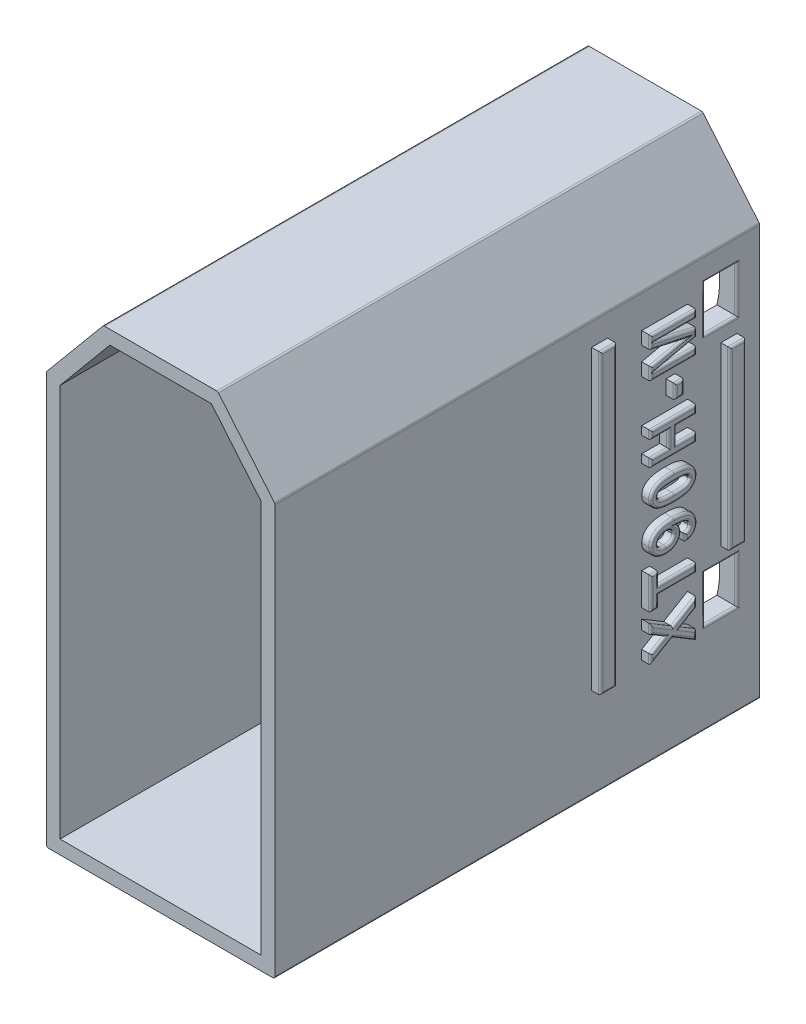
SolidWorks part; units mm, degrees
ref_plane "Спереди" through (0, 0, 0) normal (0, 0, 1) x (1, 0, 0)
ref_plane "Сверху" through (0, 0, 0) normal (0, 1, 0) x (1, 0, 0)
ref_plane "Справа" through (0, 0, 0) normal (1, 0, 0) x (0, 0, -1)
sketch "Эскиз1" plane through (0, 0, 0) normal (0, 0, 1) x (1, 0, 0)
  line L0 (-5, -10.5) -> (-5, 7.5)
  line L1 (-5, 10.5) -> (5, 10.5) construction
  line L2 (-5, 10.5) -> (-5, -10.5) construction
  line L3 (-5, -10.5) -> (5, -10.5) construction
  line L4 (5, 10.5) -> (5, -10.5) construction
  line L5 (0, -10.5) -> (0, 10.5) construction
  line L6 (-5, 0) -> (5, 0) construction
  line L7 (-5, 7.5) -> (-2.5, 10.5)
  line L8 (-2.5, 10.5) -> (2.5, 10.5)
  line L9 (-5, -10.5) -> (5, -10.5)
  line L10 (5, -10.5) -> (5, 7.5)
  line L11 (5, 7.5) -> (2.5, 10.5)
  line L12 (-4.4, -9.9) -> (4.4, -9.9)
  line L13 (4.4, -9.9) -> (4.4, 7.2828)
  line L14 (4.4, 7.2828) -> (2.219, 9.9)
  line L15 (-2.219, 9.9) -> (2.219, 9.9)
  line L16 (-4.4, 7.2828) -> (-2.219, 9.9)
  line L17 (-4.4, -9.9) -> (-4.4, 7.2828)
  point P0 (0, 0)
  dimension "D1" = 21
  dimension "D2" = 10
  dimension "D3" = 18
  dimension "D4" = 5
  dimension "D5" = 0.6
extrude "Бобышка-Вытянуть1" add sketch "Эскиз1" along normal blind 14.2
sketch "Эскиз2" plane through (0, 0, 0) normal (0, 0, -1) x (-1, 0, 0)
  line L0 (-2.5, 10.5) -> (2.5, 10.5)
  line L1 (2.5, 10.5) -> (5, 7.5)
  line L2 (5, 7.5) -> (5, -10.5)
  line L3 (5, -10.5) -> (-5, -10.5)
  line L4 (-5, -10.5) -> (-5, 7.5)
  line L5 (-5, 7.5) -> (-2.5, 10.5)
extrude "Бобышка-Вытянуть2" add sketch "Эскиз2" along normal blind 7
sketch "Эскиз3" plane through (0, 0, -7) normal (0, 0, -1) x (-1, 0, 0)
  line L0 (0, 0) -> (-5, 0) construction
  line L1 (-5, 7.5) -> (-5, -10.5) construction
  line L2 (0, -10.5) -> (0, 10.5) construction
  line L3 (-5, -10.5) -> (5, -10.5) construction
  line L4 (2.5, 10.5) -> (-2.5, 10.5) construction
  circle A0 centre (0, 5.5) radius 4.25
  circle A1 centre (0, -5.5) radius 4.25
  dimension "D1" = 8.5
  dimension "D2" = 5.5
extrude "Вырез-Вытянуть1" cut sketch "Эскиз3" against normal blind 3.2
sketch "Эскиз4" plane through (0, 0, -7) normal (0, 0, -1) x (-1, 0, 0)
  line L0 (0, 10.5) -> (0, -10.5) construction
  line L1 (2.5, 10.5) -> (-2.5, 10.5) construction
  line L2 (-5, -10.5) -> (5, -10.5) construction
  line L3 (0, -10.5) -> (5, 0) construction
  line L4 (5, -10.5) -> (5, 7.5) construction
  line L5 (5, 0) -> (-5, 0) construction
  line L6 (-5, 7.5) -> (-5, -10.5) construction
  line L7 (-3.5, 2.1425) -> (-3.5, -2.1425)
  line L8 (-3.5, 2.1425) -> (3.5, 2.1425) construction
  line L9 (-3.5, 2.1425) -> (-3.5, -2.1425) construction
  line L10 (-3.5, -2.1425) -> (3.5, -2.1425) construction
  line L11 (3.5, 2.1425) -> (3.5, -2.1425) construction
  line L12 (0, -2.1425) -> (0, 2.1425) construction
  line L13 (-3.5, 0) -> (3.5, 0) construction
  line L14 (3.5, 2.1425) -> (3.5, -2.1425)
  circle A0 centre (0, 5.5) radius 4.85 construction
  circle A1 centre (0, -5.5) radius 4.85 construction
  arc A2 (-3.5, 2.1425) -> (3.5, 2.1425) centre (0, 5.5) ccw
  arc A3 (3.5, -2.1425) -> (-3.5, -2.1425) centre (0, -5.5) ccw
  circle A4 centre (0, 5.5) radius 2.85
  circle A5 centre (0, -5.5) radius 2.85
  point P13 (0, 0)
  dimension "D3" = 9.7
  dimension "D4" = 9.7
  dimension "D1" = 5.7
  dimension "D5" = 5.7
  dimension "D2" = 7
extrude "Вырез-Вытянуть2" cut sketch "Эскиз4" against normal through all
sketch "Эскиз5" plane through (5, 0, 0) normal (1, 0, 0) x (0, 0, -1)
  line L0 (5.3, 10.5) -> (5.3, -10.5) construction
  line L1 (-14.2, 10.5) -> (7, 10.5) construction
  line L2 (-14.2, -10.5) -> (7, -10.5) construction
  line L3 (0, 0) -> (7, 0) construction
  line L4 (7, 7.5) -> (7, -10.5) construction
  line L5 (3.8, 5.5) -> (7, 5.5) construction
  line L6 (3.8, 1.25) -> (3.8, 9.75) construction
  line L7 (4.6, -4.5) -> (6, -4.5)
  line L8 (4.6, 6.5) -> (6, 6.5)
  line L9 (4.6, 6.5) -> (4.6, 4.5)
  line L10 (4.6, 4.5) -> (6, 4.5)
  line L11 (6, 6.5) -> (6, 4.5)
  line L12 (5.3, 4.5) -> (5.3, 6.5) construction
  line L13 (4.6, 5.5) -> (6, 5.5) construction
  line L14 (6, -6.5) -> (6, -4.5)
  line L15 (4.6, -6.5) -> (6, -6.5)
  line L16 (4.6, -6.5) -> (4.6, -4.5)
  point P15 (5.3, 5.5)
  dimension "D1" = 2
  dimension "D2" = 1.4
  dimension "D3" = 1
extrude "Вырез-Вытянуть3" cut sketch "Эскиз5" against normal through all
sketch "Эскиз6" plane through (5, 0, 0) normal (1, 0, 0) x (0, 0, -1)
  line L0 (5.6529, 4.5) -> (5.6529, -4.5) construction
  line L1 (4.6, 4.5) -> (6, 4.5) construction
  line L2 (6, -4.5) -> (4.6, -4.5) construction
  line L3 (0, 10.5) -> (0, -10.5) construction
  line L4 (5.3029, 3.85) -> (6.0029, 3.85)
  line L5 (5.3029, 3.85) -> (5.3029, -3.85)
  line L6 (5.3029, -3.85) -> (6.0029, -3.85)
  line L7 (6.0029, 3.85) -> (6.0029, -3.85)
  line L8 (5.6529, -3.85) -> (5.6529, 3.85) construction
  line L9 (5.3029, 0) -> (6.0029, 0) construction
  line L10 (-14.2, 10.5) -> (7, 10.5) construction
  line L11 (-14.2, -10.5) -> (7, -10.5) construction
  line L12 (7, 7.5) -> (7, -10.5) construction
  line L13 (0.35, -6.5) -> (3.8409, -6.5) construction
  line L14 (-0.35, -6.5) -> (0.35, -6.5)
  line L15 (-0.35, -6.5) -> (-0.35, 6.5)
  line L16 (-0.35, 6.5) -> (0.35, 6.5)
  line L17 (0.35, -6.5) -> (0.35, 6.5)
  line L18 (0, 6.5) -> (0, -6.5) construction
  line L19 (-0.35, 0) -> (0.35, 0) construction
  line L20 (3.8409, -6.5) -> (3.8409, 6.5) construction
  line L21 (3.8409, 6.5) -> (0.35, 6.5) construction
  text T0 "<b>XT90H-M</b>" font "Arial Narrow" height 2
  point P6 (5.6529, 0)
  point P21 (0, 0)
  dimension "D1" = 7.7
  dimension "D2" = 0.7
  dimension "D3" = 7
  dimension "D4" = 13
  dimension "D5" = 0.7
extrude "Бобышка-Вытянуть3" add sketch "Эскиз6" along normal blind 0.4
sketch "Эскиз7" plane through (-5, 0, -5) normal (1, 0, 0) x (0, 0, -1)
  line L9 (0.1058, 0) -> (0.8058, 0) construction
  line L22 (-1.3562, -6.5) -> (-4.8471, -6.5) construction
  line L23 (-1.3562, 6.5) -> (-1.3562, -6.5) construction
  line L24 (-5.5471, 0) -> (-4.8471, 0) construction
  line L25 (-5.1971, -6.5) -> (-5.1971, 6.5) construction
  line L26 (-4.8471, 6.5) -> (-1.3562, 6.5) construction
  line L27 (0.4558, 3.85) -> (0.4558, -3.85) construction
  line L28 (-5.1971, -10.5) -> (-5.1971, 10.5) construction
  line L29 (0.4558, -4.5) -> (0.4558, 4.5) construction
  line L30 (-4.8471, 6.5) -> (-4.8471, -6.5)
  line L31 (-5.5471, -6.5) -> (-4.8471, -6.5)
  line L32 (-5.5471, 6.5) -> (-5.5471, -6.5)
  line L33 (-5.5471, 6.5) -> (-4.8471, 6.5)
  line L34 (0.8058, -3.85) -> (0.8058, 3.85)
  line L35 (0.1058, 3.85) -> (0.8058, 3.85)
  line L36 (0.1058, -3.85) -> (0.1058, 3.85)
  line L37 (0.1058, -3.85) -> (0.8058, -3.85)
  text T0 "<b>XT90H-M</b>" font "Arial Narrow" height 2
  point P6 (0.4558, 0)
  point P21 (-5.1971, 0)
extrude "Бобышка-Вытянуть4" add sketch "Эскиз7" against normal blind 0.4
fillet "Скругление1" radius 0.1 102 edges at (5.4, 4.3, -2.8409) (5.4, 5.3278, -2.5361) (5.4, 5.7629, -1.8409) (5.4, 6.0403, -2.8409) (5.4, 5.8714, -3.8409) (5.4, 4.6377, -3.0408) (5.4, 3.6818, -3.1006) (5.4, 3.3701, -3.2954) (5.4, 1.0117, -2.8409) (5.4, 1.1935, -1.8409) (5.4, 2.2584, -1.8409) (5.4, 2.4403, -2.8409) (5.4, 2.2584, -3.8409) (5.4, 1.726, -2.9578) (5.4, 1.3753, -3.3993) (5.4, -4.1935, -2.1785) (5.4, -4.4532, -2.0097) (5.4, -3.5701, -3.0097) (5.4, -3.7519, -3.8409) (5.4, -6.1881, -3.3192) (5.4, -5.4868, -2.1455) (5.4, -5.1753, -2.3192) (5.4, -5.1494, -3.3192) (5.4, -5.0453, -3.8409) (5.4, -5.4608, -3.4929) (5.4, -6.2924, -3.8409) (5.4, -3.85, -5.6529) (5.4, 3.85, -5.6529) (5.4, 0, -6.0029) (5.4, -6.5, 0) (5.4, 0, 0.35) (5.4, 6.5, 0) (5.4, 0, -0.35) (-5.4, 6.1881, -3.1221) (-5.4, 6.2405, -1.6438) (-5.4, 5.4868, -1.9484) (-5.4, 5.0972, -1.6438) (-5.4, 5.1753, -2.1221) (-5.4, 5.1494, -3.1221) (-5.4, 5.0453, -3.6438) (-5.4, 5.4608, -3.2958) (-5.4, 5.8768, -3.2958) (-5.4, 6.2924, -3.6438) (-5.4, 3.9338, -2.8126) (-5.4, 4.1935, -1.9814) (-5.4, 3.7519, -1.6438) (-5.4, 3.0506, -1.8126) (-5.4, 3.3104, -1.9814) (-5.4, 3.5701, -2.8126) (-5.4, 3.7519, -3.6438) (-5.4, 2.3675, -3.1503) (-5.4, -4.3, -2.6438) (-5.4, -4.5798, -1.6438) (-5.4, -5.0149, -2.339) (-5.4, -5.7629, -1.6438) (-5.4, -6.0403, -2.6438) (-5.4, -5.8714, -3.6438) (-5.4, -5.7026, -2.8436) (-5.4, -5.5206, -2.8436) (-5.4, -4.8168, -2.8436) (-5.4, -4.6377, -2.8436) (-5.4, -3.0584, -2.9035) (-5.4, -3.3701, -2.7087) (-5.4, -3.3701, -3.0983) (-5.4, -1.0117, -2.6438) (-5.4, -1.1935, -1.6438) (-5.4, -1.726, -2.423) (-5.4, -2.0766, -2.0334) (-5.4, -2.2584, -1.6438) (-5.4, -2.2584, -3.6438) (-5.4, -1.3753, -3.2022) (-5.4, -3.85, -5.4558) (-5.4, 0, -0.1529) (5, -4.5, -5.3) (5, -5.5, -6) (5, 6.5, -5.3) (5, 5.5, -4.6) (-5, 5.5, -6) (-5, 5.5, -4.6) (-5, 6.5, -5.3) (-5, -6.5, -5.3) (-5, -5.5, -4.6) (-5, -10.5, 3.6) (5, -10.5, 3.6) (2.5, 10.5, 3.6) (-5, 7.5, 3.6)
